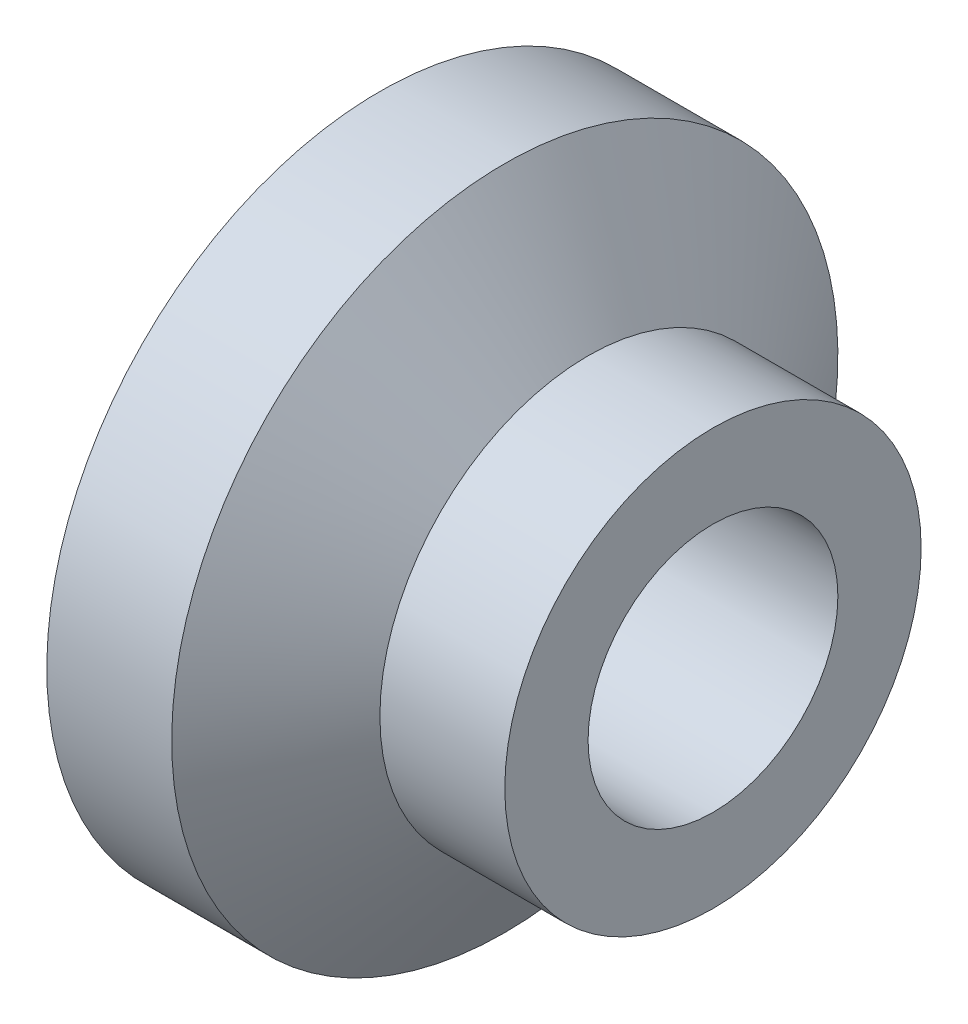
SolidWorks part; units mm, degrees
ref_plane "Plan de face" through (0, 0, 0) normal (0, 0, 1) x (1, 0, 0)
ref_plane "Plan de dessus" through (0, 0, 0) normal (0, 1, 0) x (1, 0, 0)
ref_plane "Plan de droite" through (0, 0, 0) normal (1, 0, 0) x (0, 0, -1)
sketch "Esquisse1" plane through (0, 0, 0) normal (0, 0, 1) x (1, 0, 0)
  line L0 (-58.0042, 0) -> (66.0042, 0) construction
  line L1 (0, 0) -> (0, 4)
  line L2 (0, 4) -> (1.5, 4)
  line L3 (0, 0) -> (4, 0)
  line L4 (4, 0) -> (4, 2.5)
  line L5 (4, 2.5) -> (2.5, 2.5)
  line L6 (2.5, 2.5) -> (1.5, 4)
  dimension "D1" = 4
  dimension "D2" = 1.5
  dimension "D3" = 4
  dimension "D4" = 2.5
  dimension "D5" = 1.5
revolve "Révolution1" add sketch "Esquisse1" angle 360 about L0
sketch "Esquisse2" plane through (0, 0, 0) normal (-1, 0, 0) x (0, 0, 1)
  circle A0 centre (0, 0) radius 1.5
  dimension "D1" = 3
extrude "Enlèv. mat.-Extru.1" cut sketch "Esquisse2" against normal through all
